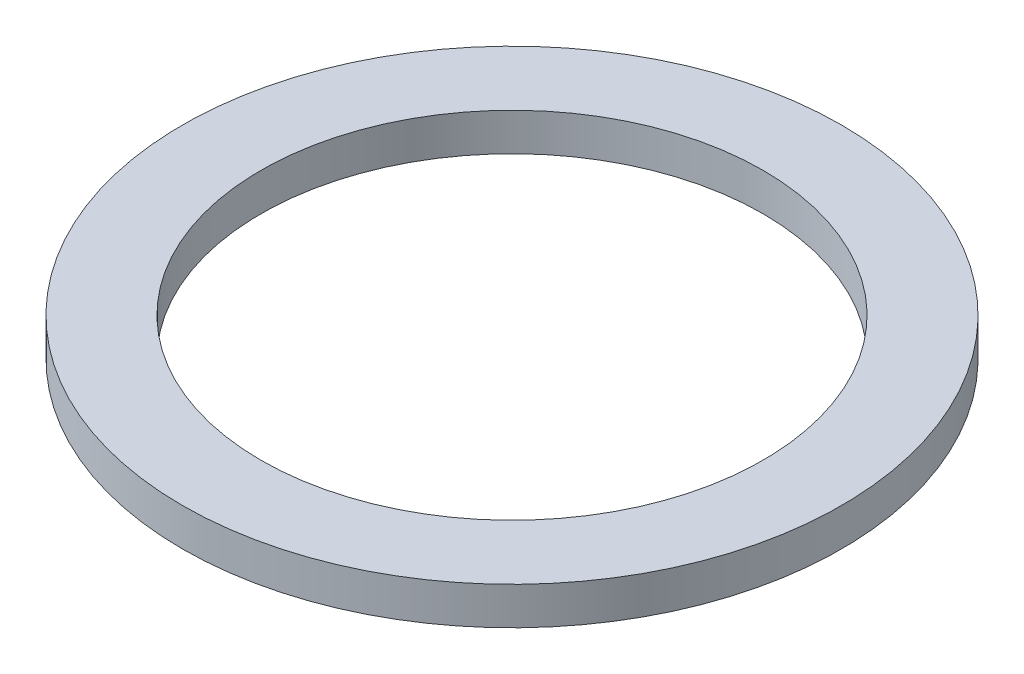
SolidWorks part; units mm, degrees
ref_plane "前视基准面" through (0, 0, 0) normal (0, 0, 1) x (1, 0, 0)
ref_plane "上视基准面" through (0, 0, 0) normal (0, 1, 0) x (1, 0, 0)
ref_plane "右视基准面" through (0, 0, 0) normal (1, 0, 0) x (0, 0, -1)
sketch "草图1" plane through (0, 0, 0) normal (0, 1, 0) x (1, 0, 0)
  circle A0 centre (0, 0) radius 40
  circle A1 centre (0, 0) radius 52.5
  dimension "D1" = 80
  dimension "D2" = 105
extrude "凸台-拉伸1" add sketch "草图1" along normal blind 6
